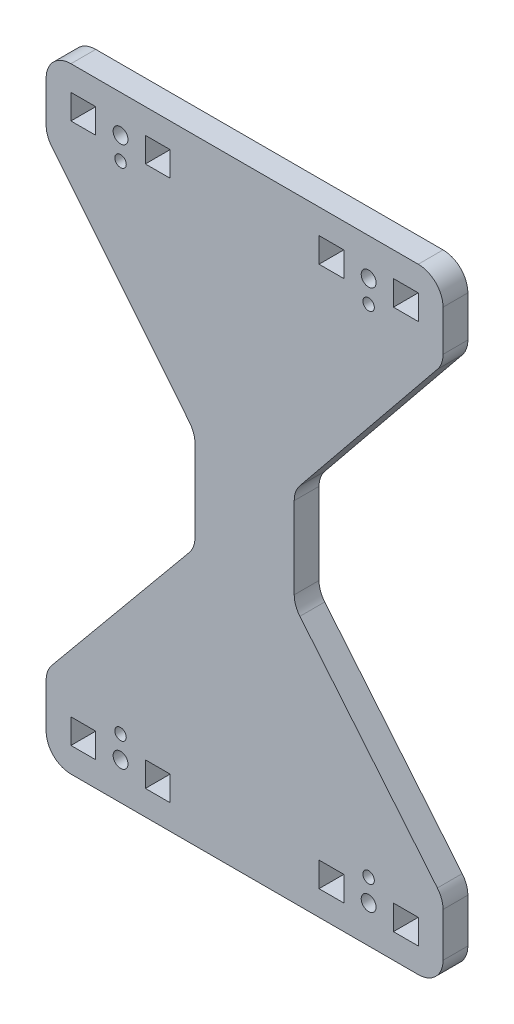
SolidWorks part; units mm, degrees
ref_plane "Front Plane" through (0, 0, 0) normal (0, 0, 1) x (1, 0, 0)
ref_plane "Top Plane" through (0, 0, 0) normal (0, 1, 0) x (1, 0, 0)
ref_plane "Right Plane" through (0, 0, 0) normal (1, 0, 0) x (0, 0, -1)
sketch "Sketch1" plane through (0, 0, 0) normal (0, 0, 1) x (1, 0, 0)
  line L0 (0, 62) -> (80, 62) construction
  line L1 (0, 0) -> (80, 0)
  line L2 (0, 0) -> (0, 124) construction
  line L3 (0, 124) -> (80, 124)
  line L4 (80, 0) -> (80, 124) construction
  line L5 (40, 0) -> (40, 124) construction
  line L6 (0, 124) -> (0, 109)
  line L7 (0, 109) -> (30, 72)
  line L8 (30, 72) -> (30, 52)
  line L9 (30, 52) -> (0, 15.6694)
  line L10 (0, 15.6694) -> (0, 0)
  line L11 (80, 0) -> (80, 15.6694)
  line L12 (80, 15.6694) -> (50, 52)
  line L13 (50, 52) -> (50, 72)
  line L14 (50, 72) -> (80, 109)
  line L15 (80, 109) -> (80, 124)
  circle A0 centre (15, 112) radius 1.15
  circle A1 centre (65, 112) radius 1.15
  circle A2 centre (15, 12) radius 1.15
  circle A3 centre (65, 12) radius 1.15
  line B0 (60, 10) -> (55, 10)
  line B1 (60, 10) -> (60, 5)
  line B2 (60, 5) -> (55, 5)
  line B3 (55, 10) -> (55, 5)
  line B4 (70, 10) -> (75, 10)
  line B5 (70, 10) -> (70, 5)
  line B6 (70, 5) -> (75, 5)
  line B7 (75, 10) -> (75, 5)
  circle B8 centre (65, 7.5) radius 1.5
  line B9 (20, 10) -> (25, 10)
  line B10 (20, 10) -> (20, 5)
  line B11 (20, 5) -> (25, 5)
  line B12 (25, 10) -> (25, 5)
  line B13 (10, 10) -> (5, 10)
  line B14 (10, 10) -> (10, 5)
  line B15 (10, 5) -> (5, 5)
  line B16 (5, 10) -> (5, 5)
  circle B17 centre (15, 7.5) radius 1.5
  line B18 (60, 114) -> (55, 114)
  line B19 (60, 114) -> (60, 119)
  line B20 (60, 119) -> (55, 119)
  line B21 (55, 114) -> (55, 119)
  line B22 (70, 114) -> (75, 114)
  line B23 (70, 114) -> (70, 119)
  line B24 (70, 119) -> (75, 119)
  line B25 (75, 114) -> (75, 119)
  line B26 (65, 116.5) -> (65, 109.5276) construction
  circle B27 centre (65, 116.5) radius 1.5
  line B28 (20, 114) -> (25, 114)
  line B29 (20, 114) -> (20, 119)
  line B30 (20, 119) -> (25, 119)
  line B31 (25, 114) -> (25, 119)
  line B32 (10, 114) -> (5, 114)
  line B33 (10, 114) -> (10, 119)
  line B34 (10, 119) -> (5, 119)
  line B35 (5, 114) -> (5, 119)
  line B36 (15, 116.5) -> (15, 109.5276) construction
  circle B37 centre (15, 116.5) radius 1.5
  dimension "D5" = 100
  dimension "D7" = 2.3
  dimension "D1" = 5
  dimension "D2" = 5
  dimension "D3" = 104
  dimension "D4" = 50
  dimension "D6" = 50
  dimension "D8" = 15
  dimension "D9" = 20
  dimension "D10" = 20
sketch_block_instance "Trou M3 plots 5mm-1"
sketch_block "Trou M3 plots 5mm" parameters "D2"=3, "D1"=5, "D3"=5, "D4"=10
sketch_block_instance "Trou M3 plots 5mm-3"
sketch_block_instance "Trou M3 plots 5mm-4"
sketch_block_instance "Trou M3 plots 5mm-5"
extrude "Boss-Extrude1" add sketch "Sketch1" along normal blind 5
fillet "Fillet1" radius 5 12 edges at (80, 124, 2.5) (80, 109, 2.5) (50, 72, 2.5) (50, 52, 2.5) (80, 15.6694, 2.5) (80, 0, 2.5) (0, 0, 2.5) (0, 15.6694, 2.5) (30, 52, 2.5) (30, 72, 2.5) (0, 109, 2.5) (0, 124, 2.5)
